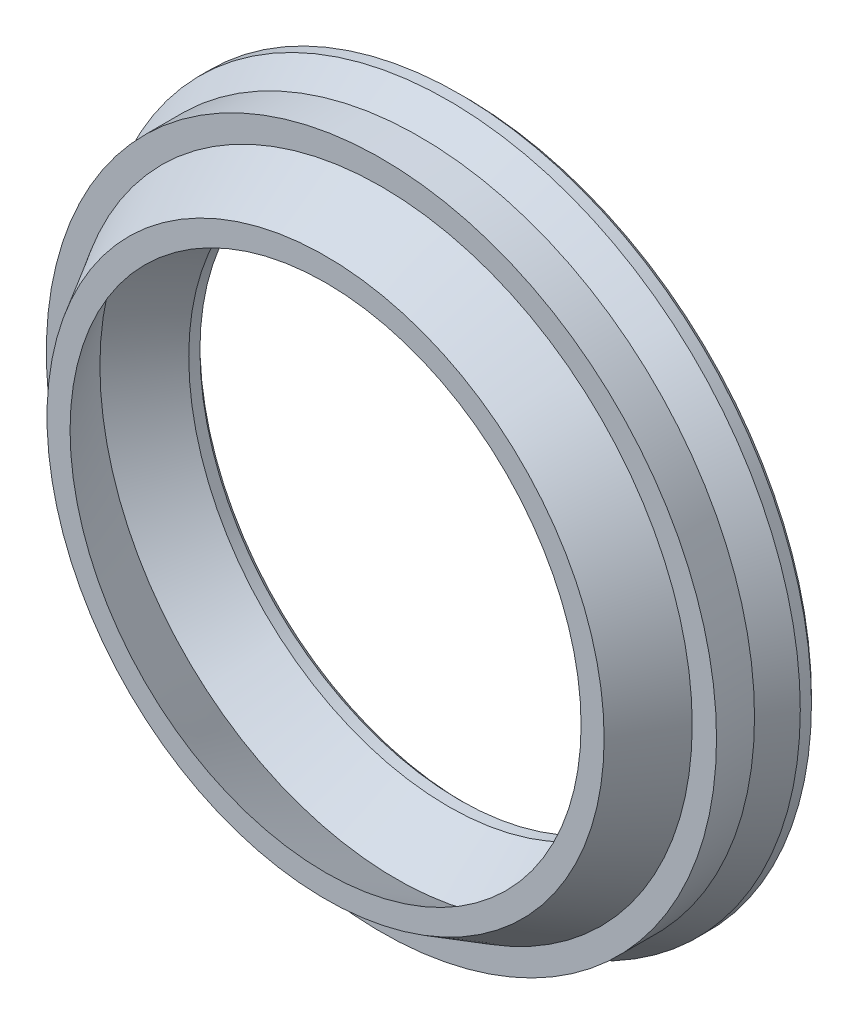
SolidWorks part; units mm, degrees
ref_plane "Front" through (0, 0, 0) normal (0, 0, 1) x (1, 0, 0)
ref_plane "Top" through (0, 0, 0) normal (0, 1, 0) x (1, 0, 0)
ref_plane "Right" through (0, 0, 0) normal (1, 0, 0) x (0, 0, -1)
other "Configuration Table"
sketch "Sketch1" plane through (21, 0, -3.1487) normal (0, 1, 0) x (-1, 0, 0)
  line L0 (21, 10.6441) -> (21, -7.4954) construction
  line L1 (41, -2.4526) -> (41, -0.1846)
  line L2 (41, -0.1846) -> (39.5495, -0.1846)
  line L3 (39.5495, -0.1846) -> (37.625, 3.1487)
  line L4 (37.625, 3.1487) -> (36.25, 3.1487)
  line L5 (41, -2.4526) -> (42, -4.1846)
  line L6 (42, -4.1846) -> (42, -5.1846)
  line L7 (42, -5.1846) -> (36.5, -5.1846)
  line L8 (36.5, -5.1846) -> (36.5, -4.1846)
  line L9 (36.5, -4.1846) -> (38.6835, -1.0662)
  line L10 (38.6835, -1.0662) -> (36.25, 3.1487)
revolve "Body" add sketch "Sketch1" angle 360 about L0
sketch "Sketch2" plane through (19.25, 0, -11.3374) normal (0, 1, 0) x (-1, 0, 0)
  line L0 (19.25, 13.8484) -> (19.25, -2.511) construction
  line L2 (1, -0.9653) -> (1, -0.0415) construction
  line L3 (2, 3.0041) -> (0, 3.0041)
  line L5 (0, 3.0041) -> (0.4619, 3.8041)
  line L6 (0.4619, 3.8041) -> (1.5381, 3.8041)
  line L7 (1.5381, 3.8041) -> (2, 3.0041)
  line L9 (-1.75, 4.0041) -> (-1.75, 3.0041) construction
  line L10 (-1.75, 3.0041) -> (40.25, 3.0041) construction
  dimension "D1" = 2.75
  dimension "D2" = 0.8
  dimension "D3" = 60
  dimension "D4" = 2
revolve "Cut-Revolve1" cut sketch "Sketch2" angle 360 about L0
chamfer "EndChamfer" distance 0.3333 angle 45 2 edges at (15.5, 0, -8.3333) (21, 0, -8.3333)
equation "\"D5@Sketch1\" = \"h@Sketch1\" / 5"
equation "\"D9@Sketch1\" = \"S@Sketch1\" / 4"
equation "\"D6@Sketch1\" = 2 * \"h@Sketch1\" / 3"
equation "\"D1@EndChamfer\" = \"h@Sketch1\" / 15"
